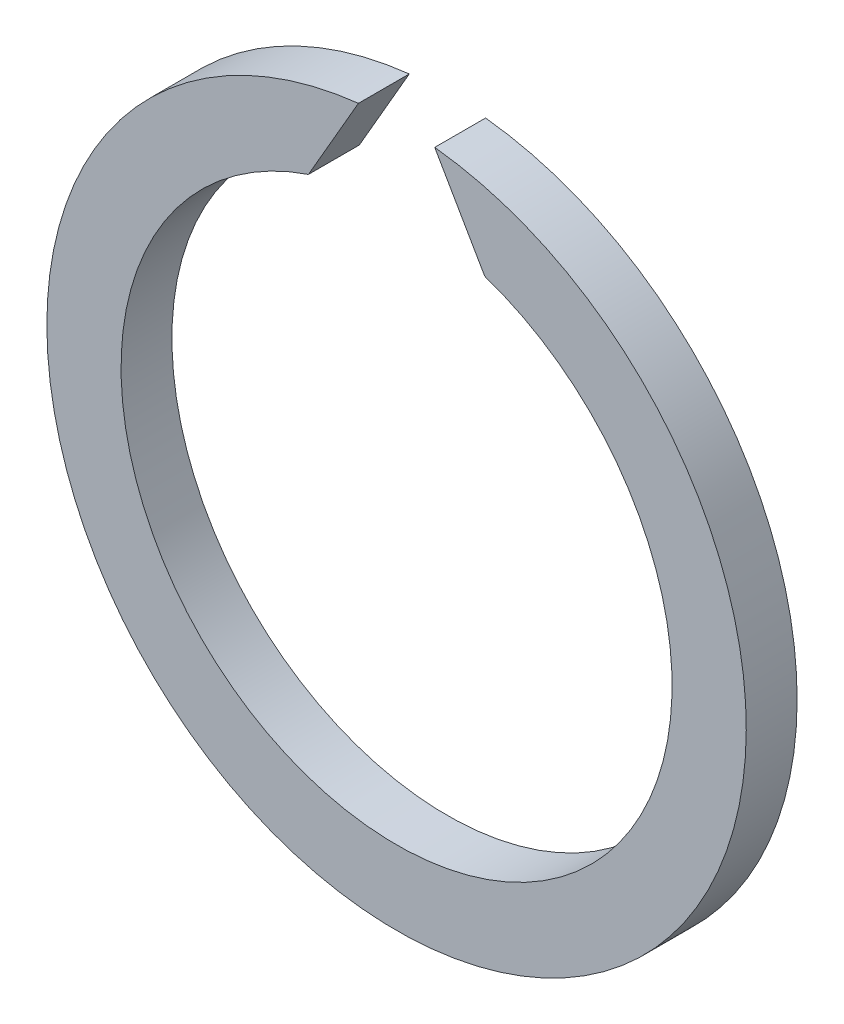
SolidWorks part; units mm, degrees
ref_plane "Front Plane" through (0, 0, 0) normal (0, 0, 1) x (1, 0, 0)
ref_plane "Top Plane" through (0, 0, 0) normal (0, 1, 0) x (1, 0, 0)
ref_plane "Right Plane" through (0, 0, 0) normal (1, 0, 0) x (0, 0, -1)
sketch "Sketch1" plane through (0, 0, 0) normal (0, 0, 1) x (1, 0, 0)
  line L0 (0, 0) -> (0, 9.6683) construction
  line L3 (-2.0791, 6.1585) -> (-0.9, 8.2008)
  line L7 (2.0791, 6.1585) -> (0.9, 8.2008)
  arc A0 (-0.9, 8.2008) -> (0.9, 8.2008) centre (0, 0) ccw
  arc A1 (-2.0791, 6.1585) -> (2.0791, 6.1585) centre (0, 0) ccw
  dimension "D1" = 13
  dimension "D2" = 1.75
  dimension "D3" = 1.8
  dimension "D4" = 60
extrude "Boss-Extrude1" add sketch "Sketch1" along normal blind 1.2
